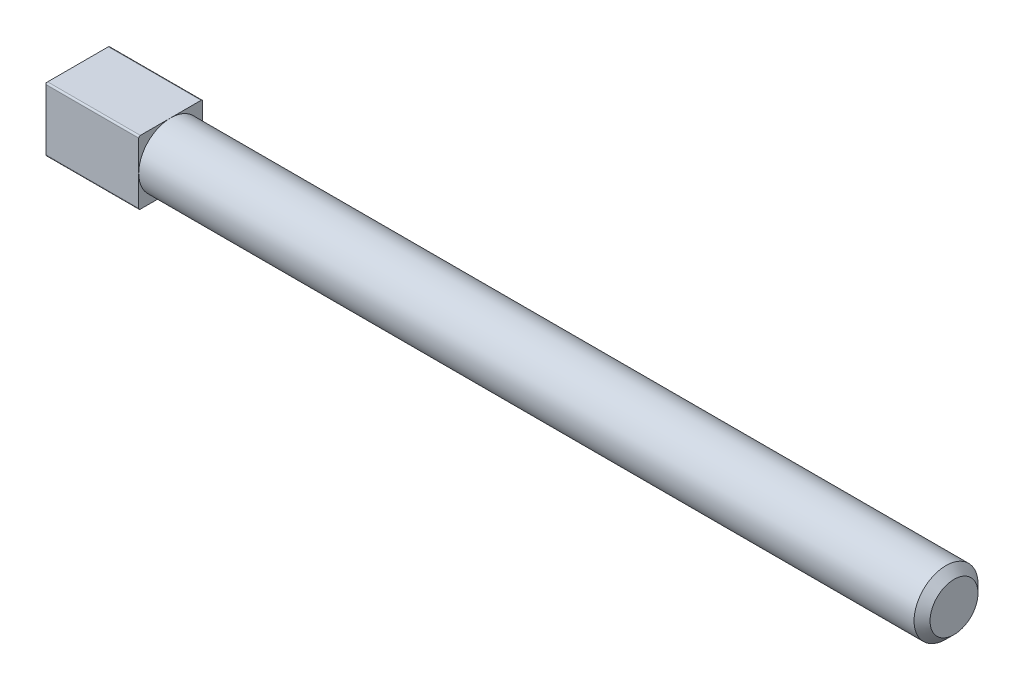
SolidWorks part; units mm, degrees
ref_plane "前视基准面" through (0, 0, 0) normal (0, 0, 1) x (1, 0, 0)
ref_plane "上视基准面" through (0, 0, 0) normal (0, 1, 0) x (1, 0, 0)
ref_plane "右视基准面" through (0, 0, 0) normal (1, 0, 0) x (0, 0, -1)
sketch "草图1" plane through (0, 0, 0) normal (1, 0, 0) x (0, 0, -1)
  line L0 (2, -2) -> (2, 2)
  line L1 (2, -2) -> (-2, -2)
  line L2 (2, 2) -> (-2, 2)
  line L3 (-2, -2) -> (-2, 2)
  line L4 (2, -2) -> (-2, 2) construction
  line L5 (2, 2) -> (-2, -2) construction
  point P1 (0, 0)
  dimension "D1" = 4
  dimension "D2" = 4
extrude "凸台-拉伸1" add sketch "草图1" along normal blind 6
sketch "草图2" plane through (6, 0, 0) normal (1, 0, 0) x (0, 0, -1)
  circle A0 centre (0, 0) radius 2
extrude "凸台-拉伸2" add sketch "草图2" along normal blind 49
chamfer "倒角1" distance 0.5 angle 45 1 edges at (55, 0, -2)
chamfer "倒角2" distance 0.2 angle 45 4 edges at (0, 0, -2) (0, 2, 0) (0, 0, 2) (0, -2, 0)
fillet "圆角1" radius 0.1 4 edges at (3.1, 2, -2) (3.1, -2, -2) (3.1, -2, 2) (3.1, 2, 2)
